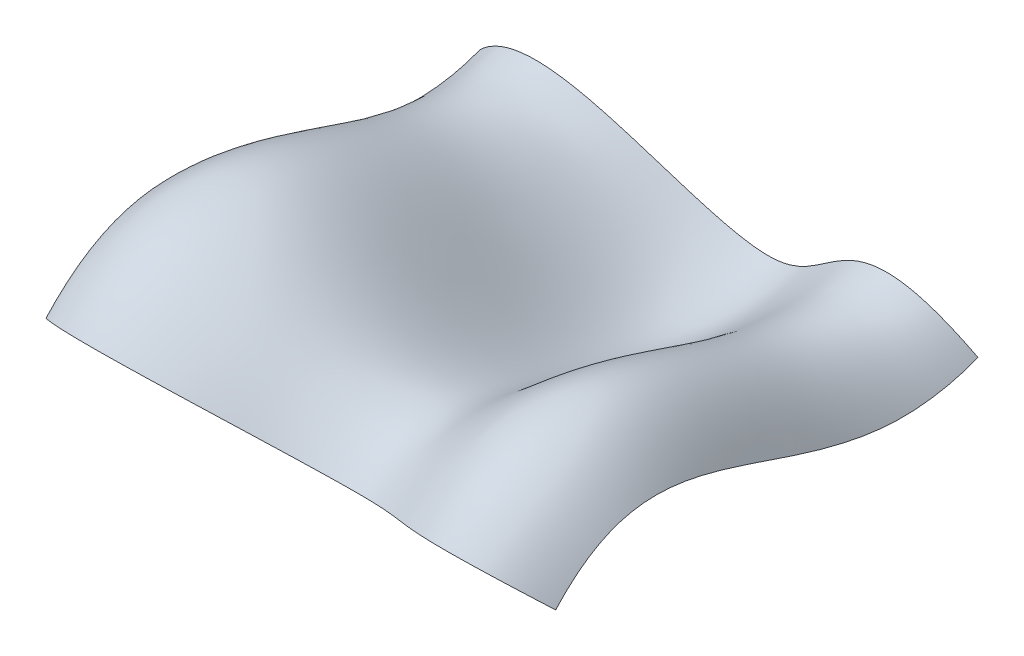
SolidWorks part; units mm, degrees
ref_plane "Front Plane" through (0, 0, 0) normal (0, 0, 1) x (1, 0, 0)
ref_plane "Top Plane" through (0, 0, 0) normal (0, 1, 0) x (1, 0, 0)
ref_plane "Right Plane" through (0, 0, 0) normal (1, 0, 0) x (0, 0, -1)
sketch "Sketch1" plane through (0, 0, 0) normal (1, 0, 0) x (0, 0, -1)
  spline S0 degree 3 poles (-81.7388, 22.5697) (-22.1774, 88.2281) (40.3018, 2.3227) (106.3418, 28.8729) knots 0 0 0 0 1 1 1 1
ref_plane "Plane1" through (0, 28.8729, -106.3418) normal (0, 0.373, -0.9278) x (-1, 0, 0)
sketch "Sketch2" plane through (0, 28.8729, -106.3418) normal (0, 0.373, -0.9278) x (-1, 0, 0)
  spline S0 degree 3 poles (-82.5623, -11.8776) (-44.4296, 42.01) (12.4672, -95.6347) (84.4595, 48.8531) (128.8868, 1.9451) knots 0 0 0 0 0.443178 1 1 1 1
surface "Surface-Sweep1"
